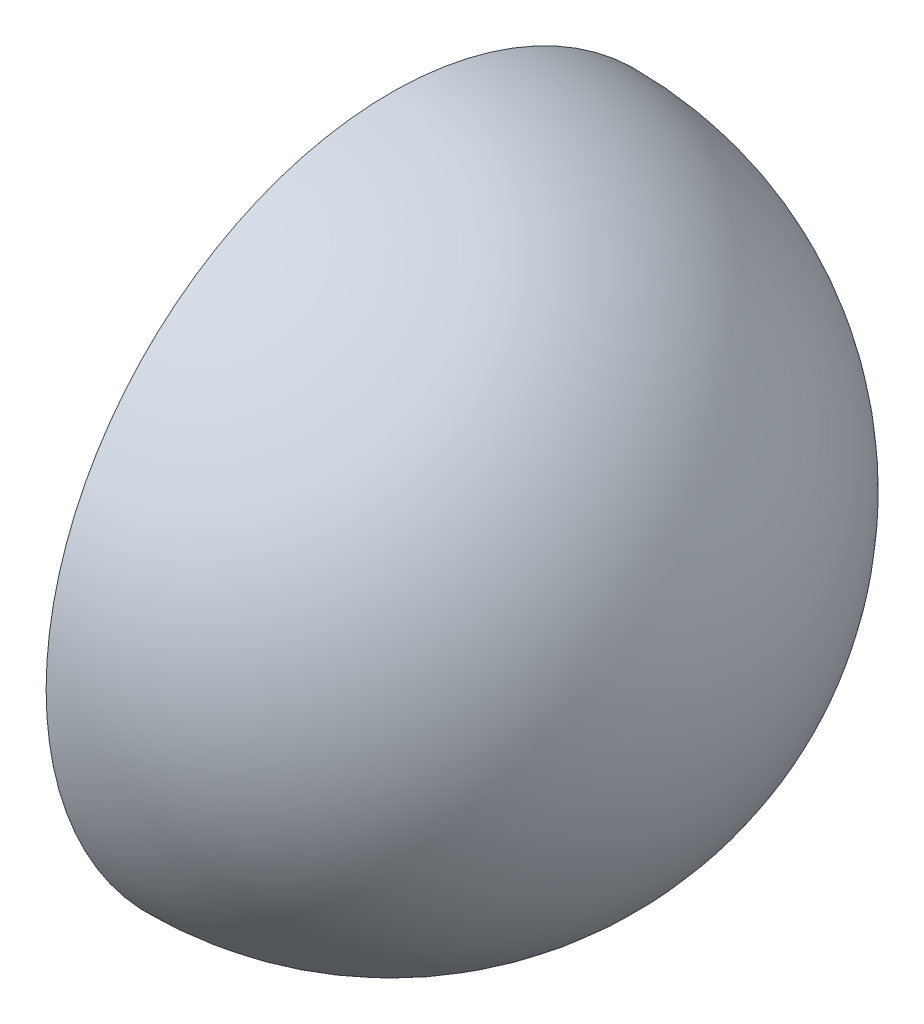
SolidWorks part; units mm, degrees
ref_plane "Front Plane" through (0, 0, 0) normal (0, 0, 1) x (1, 0, 0)
ref_plane "Top Plane" through (0, 0, 0) normal (0, 1, 0) x (1, 0, 0)
ref_plane "Right Plane" through (0, 0, 0) normal (1, 0, 0) x (0, 0, -1)
sketch "Sketch1" plane through (0, 0, 0) normal (1, 0, 0) x (0, 0, -1)
  line L0 (0, 76.2) -> (0, 101.6)
  line L2 (0, -76.2) -> (0, -101.6)
  arc A0 (0, 76.2) -> (0, -76.2) centre (0, 0) ccw
  arc A1 (0, 101.6) -> (0, -101.6) centre (0, 0) ccw
  dimension "D1" = 152.4
revolve "Revolve1" add sketch "Sketch1" angle 180 about L0
